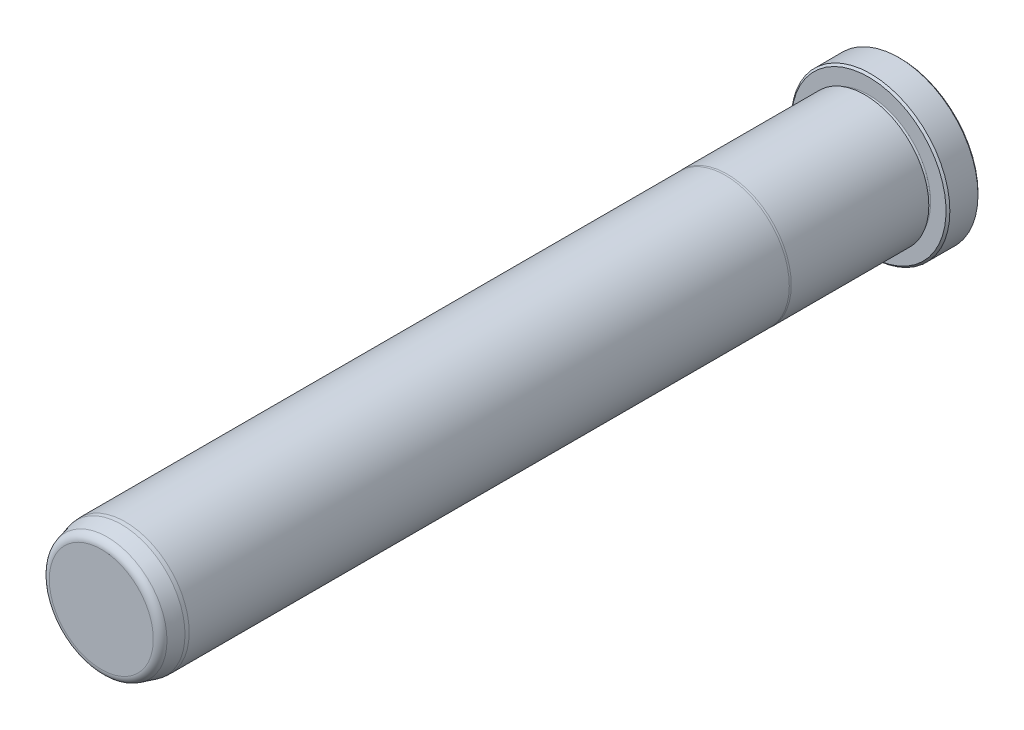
SolidWorks part; units mm, degrees
ref_plane "Front Plane" through (0, 0, 0) normal (0, 0, 1) x (1, 0, 0)
ref_plane "Top Plane" through (0, 0, 0) normal (0, 1, 0) x (1, 0, 0)
ref_plane "Right Plane" through (0, 0, 0) normal (1, 0, 0) x (0, 0, -1)
sketch "Sketch1" plane through (0, 0, 0) normal (1, 0, 0) x (0, 0, -1)
  line L0 (0, 0) -> (0, 15.748)
  line L1 (0, 15.748) -> (-6.35, 15.748)
  line L2 (-6.35, 15.748) -> (-6.35, 12.3063)
  line L3 (-6.35, 11.9253) -> (-7.112, 11.9253) construction
  line L4 (-7.112, 12.3063) -> (-7.112, 12.7127)
  line L5 (-7.112, 12.7127) -> (-34.4348, 12.7127)
  line L6 (-34.4348, 12.7127) -> (-34.798, 12.6873)
  line L7 (-34.798, 12.6873) -> (-153.9875, 12.6873)
  line L9 (-158.75, 11.5487) -> (-158.75, 0)
  line L10 (-158.75, 0) -> (0, 0)
  line L11 (0, 0) -> (13.6287, 0) construction
  line L12 (-153.9875, 12.6873) -> (-154.7495, 12.6206)
  line L13 (-154.7495, 12.6206) -> (-158.75, 11.5487)
  arc A0 (-7.112, 12.3063) -> (-6.35, 12.3063) centre (-6.731, 12.3063) ccw
  dimension "D14" = 0.762
  dimension "D1" = 6.35
  dimension "D2" = 0.762
  dimension "D3" = 31.496
  dimension "D4" = 25.4254
  dimension "D5" = 34.798
  dimension "D6" = 158.75
  dimension "D7" = 0.7874
  dimension "D8" = 4
  dimension "D9" = 25.3746
  dimension "D10" = 5
  dimension "D11" = 15
  dimension "D12" = 0.762
  dimension "D13" = 4.7625
revolve "Revolve1" add sketch "Sketch1" angle 360 about L11
fillet "Fillet6" radius 1.5875 1 edges at (11.5487, 0, 158.75)
chamfer "Chamfer1" distance 0.381 angle 45 2 edges at (15.748, 0, 0) (15.748, 0, 6.35)
